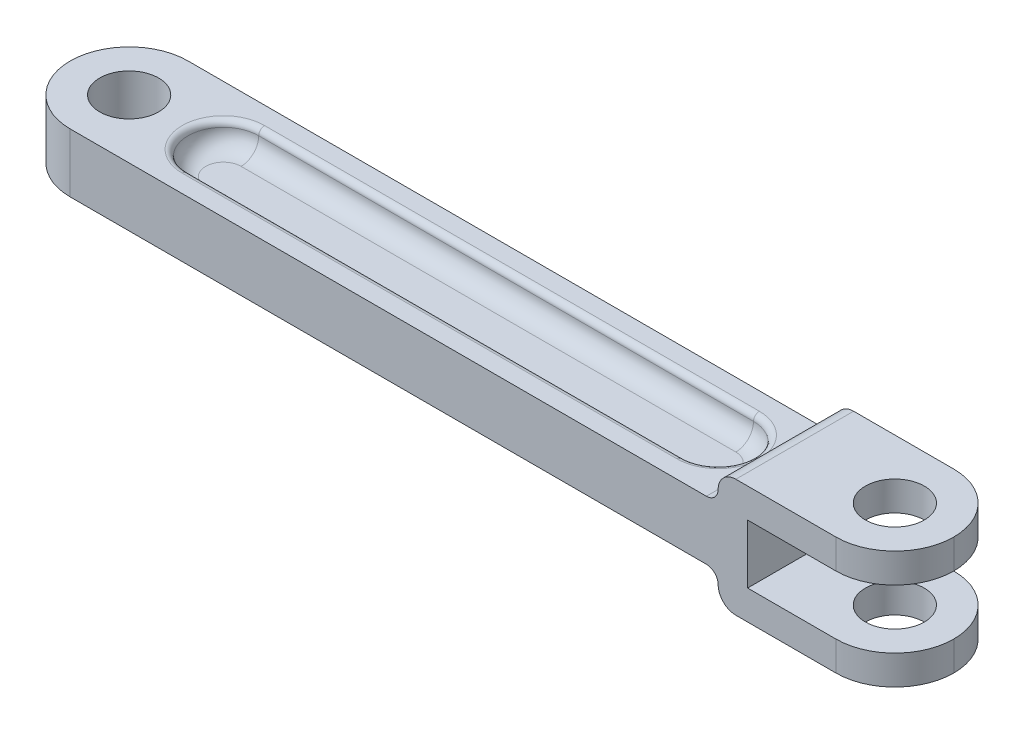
SolidWorks part; units mm, degrees
ref_plane "Front Plane" through (0, 0, 0) normal (0, 0, 1) x (1, 0, 0)
ref_plane "Top Plane" through (0, 0, 0) normal (0, 1, 0) x (1, 0, 0)
ref_plane "Right Plane" through (0, 0, 0) normal (1, 0, 0) x (0, 0, -1)
sketch "Sketch1" plane through (0, 0, 0) normal (0, 0, 1) x (1, 0, 0)
  line L0 (-17.6732, 0) -> (26.4067, 0) construction
  line L13 (-15.0646, 1.25) -> (-15.0646, -1.25)
  line L14 (-15.0646, -1.25) -> (14.9354, -1.25)
  line L15 (14.9354, -1.25) -> (14.9354, -2.5)
  line L16 (14.9354, -2.5) -> (22.4354, -2.5)
  line L17 (22.4354, -2.5) -> (22.4354, -1.25)
  line L18 (22.4354, -1.25) -> (16.1854, -1.25)
  line L19 (16.1854, -1.25) -> (16.1854, 0)
  line L20 (22.4354, 1.25) -> (16.1854, 1.25)
  line L21 (14.9354, 1.25) -> (14.9354, 2.5)
  line L22 (14.9354, 2.5) -> (22.4354, 2.5)
  line L23 (-15.0646, 1.25) -> (14.9354, 1.25)
  line L24 (16.1854, 0) -> (16.1854, 1.25)
  line L25 (22.4354, 2.5) -> (22.4354, 1.25)
  point P5 (-15.0646, 0)
  point P6 (-12.5646, 0)
  point P7 (19.9354, 0)
  dimension "D3" = 32.5
  dimension "D1" = 2.5
  dimension "D2" = 2.5
  dimension "D4" = 5
  dimension "D5" = 2.5
  dimension "D6" = 6.25
  dimension "D7" = 2.5
  dimension "D8" = 1.25
  dimension "D9" = 1.25
extrude "Boss-Extrude1" add sketch "Sketch1" along normal blind 5
fillet "Fillet8" radius 2.5 6 edges at (22.4354, -1.875, 5) (22.4354, -1.875, 0) (22.4354, 1.875, 0) (22.4354, 1.875, 5) (-15.0646, 0, 0) (-15.0646, 0, 5)
sketch "Sketch5" plane through (0, 1.25, 0) normal (0, 1, 0) x (1, 0, 0)
  circle A0 centre (-12.5646, -2.5) radius 1.25
  dimension "D1" = 2.5
extrude "Cut-Extrude4" cut sketch "Sketch5" against normal through all
sketch "Sketch6" plane through (0, 2.5, 0) normal (0, 1, 0) x (1, 0, 0)
  circle A0 centre (19.9354, -2.5) radius 1.25
  dimension "D1" = 2.5
extrude "Cut-Extrude5" cut sketch "Sketch6" against normal through all
fillet "Fillet9" radius 0.75 2 edges at (14.9354, -2.5, 2.5) (14.9354, 2.5, 2.5)
fillet "Fillet10" radius 0.5 2 edges at (14.9354, -1.25, 2.5) (14.9354, 1.25, 2.5)
sketch "Sketch7" plane through (0, 1.25, 0) normal (0, 1, 0) x (1, 0, 0)
  line L0 (-8.5646, -2.5) -> (12.4354, -2.5) construction
  line L1 (-8.5646, -1) -> (12.4354, -1)
  line L2 (-8.5646, -4) -> (12.4354, -4)
  arc A0 (-8.5646, -1) -> (-8.5646, -4) centre (-8.5646, -2.5) ccw
  arc A1 (12.4354, -4) -> (12.4354, -1) centre (12.4354, -2.5) ccw
  circle A2 centre (-12.5646, -2.5) radius 1.25 construction
  circle A3 centre (-12.5646, -2.5) radius 1.25
  point P3 (1.9354, -2.5)
  dimension "D3" = 1.5
  dimension "D1" = 4
  dimension "D2" = 21
extrude "Cut-Extrude6" cut sketch "Sketch7" against normal blind 1
mirror "Mirror2" about plane through (0, 0, 0) normal (0, 1, 0) of "Cut-Extrude6"
fillet "Fillet11" radius 0.75 8 edges at (1.9354, -0.25, 1) (13.9354, -0.25, 2.5) (1.9354, -0.25, 4) (1.9354, 0.25, 1) (13.9354, 0.25, 2.5) (1.9354, 0.25, 4) (-10.0646, -0.25, 2.5) (-10.0646, 0.25, 2.5)
fillet "Fillet12" radius 0.25 8 edges at (1.9354, -1.25, 1) (13.9354, -1.25, 2.5) (1.9354, -1.25, 4) (1.9354, 1.25, 1) (13.9354, 1.25, 2.5) (1.9354, 1.25, 4) (-10.0646, -1.25, 2.5) (-10.0646, 1.25, 2.5)
